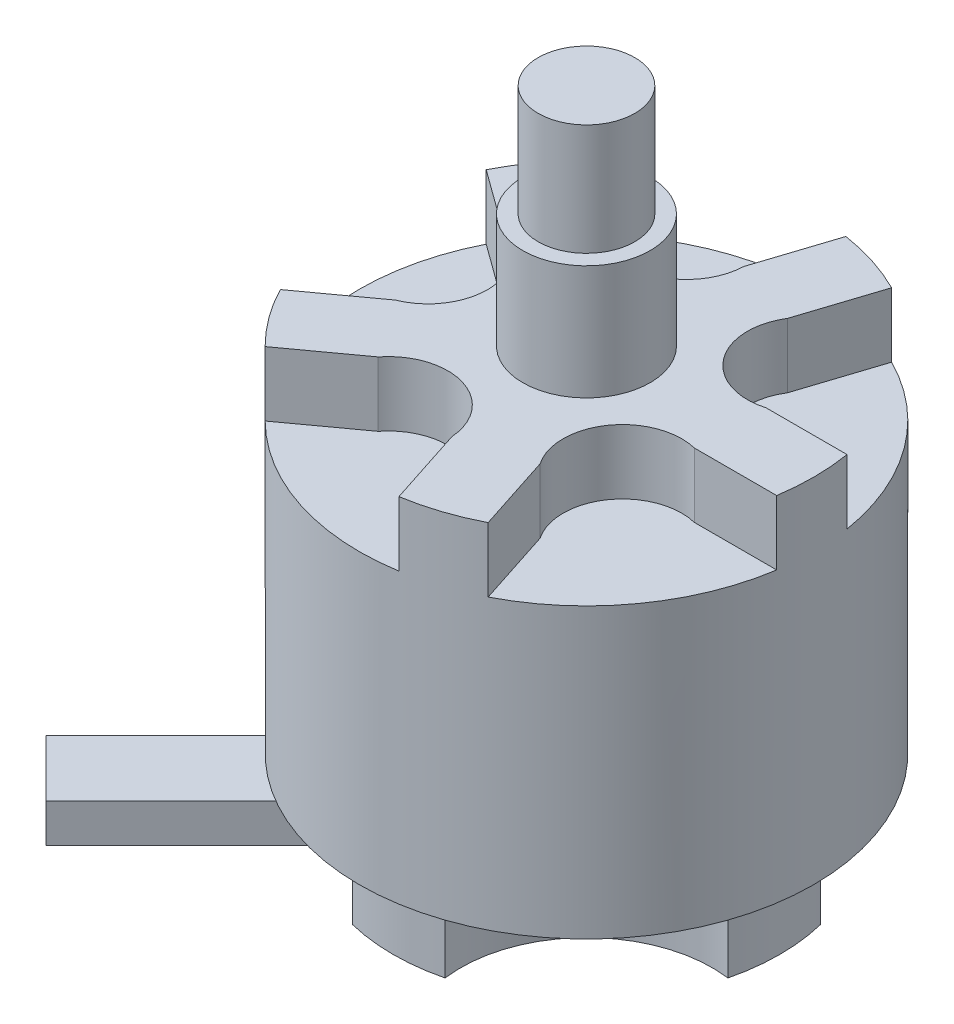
SolidWorks part; units mm, degrees
ref_plane "前视基准面" through (0, 0, 0) normal (0, 0, 1) x (1, 0, 0)
ref_plane "上视基准面" through (0, 0, 0) normal (0, 1, 0) x (1, 0, 0)
ref_plane "右视基准面" through (0, 0, 0) normal (1, 0, 0) x (0, 0, -1)
sketch "草图1" plane through (0, 0, 0) normal (0, 0, 1) x (1, 0, 0)
  line L0 (0, 0) -> (0, 40) construction
  line L1 (0, 40) -> (3, 40)
  line L2 (3, 40) -> (3, 27)
  line L3 (4, 26) -> (12.3968, 26)
  line L4 (14.3968, 22) -> (14.3968, 0)
  line L5 (14.3968, 0) -> (0, 0)
  line L6 (3, 27) -> (4, 26)
  line L7 (12.3968, 26) -> (14.3968, 22)
  line L8 (0, 40) -> (0, 0)
  point P4 (3, 26)
  point P5 (14.3968, 26)
  dimension "D1" = 2
  dimension "D2" = 4
  dimension "D4" = 3
  dimension "D5" = 40
  dimension "D6" = 26
revolve "旋转1" add sketch "草图1" angle 360 about L0
chamfer "倒角1" distance 2 angle 45 1 edges at (0, 0, -14.3968)
hole_wizard "M3 螺纹孔2" positions "草图6" profile "草图5" tap size "M3" standard "GB"
sketch "草图6" plane through (0, 0, 0) normal (0, -1, 0) x (-1, 0, 0)
  point P0 (0, -9.5)
  point P2 (-8, 0)
  point P4 (0, 9.5)
  point P6 (8, 0)
  dimension "D1" = 9.5
  dimension "D2" = 9.5
  dimension "D3" = 8
  dimension "D4" = 8
sketch "草图5" plane through (0, 0, 9.5) normal (1, 0, 0) x (0, 0, -1)
  line L0 (0, 0) -> (0, 4.5511)
  line L1 (0, 4.5511) -> (1.25, 3.8)
  line L2 (1.25, 3.8) -> (1.25, 0)
  line L5 (1.25, 0) -> (0, 0)
  line L10 (0, 4.5511) -> (-1.25, 3.8) construction
  line L11 (0, -6.35) -> (0, 107.95) construction
  dimension "螺纹孔钻头直径" = 2.5
  dimension "螺纹孔钻头深度" = 3.8
  dimension "导头角度" = 118
sketch "草图7" plane through (0, 26, 0) normal (0, 1, 0) x (1, 0, 0)
  circle A0 centre (0, 0) radius 14.1
  circle A1 centre (0, 0) radius 14.3968
  dimension "D1" = 28.2
extrude "切除-拉伸1" cut sketch "草图7" against normal blind 46
sketch "草图8" plane through (0, 0, 0) normal (0, -1, 0) x (1, 0, 0)
  circle A0 centre (0, 0) radius 12
  circle A1 centre (0, 0) radius 17.8108
extrude "切除-拉伸2" cut sketch "草图8" against normal blind 6.3
sketch "草图9" plane through (0, 26, 0) normal (0, 1, 0) x (1, 0, 0)
  circle A0 centre (0, 0) radius 12.3968
extrude "凸台-拉伸1" add sketch "草图9" along normal blind 0.7
sketch "草图10" plane through (0, 40, 0) normal (0, 1, 0) x (1, 0, 0)
  circle A0 centre (0, 0) radius 3.95
  dimension "D1" = 7.9
extrude "凸台-拉伸2" add sketch "草图10" against normal blind 13.7
sketch "草图11" plane through (0, 40, 0) normal (0, 1, 0) x (1, 0, 0)
  circle A0 centre (0, 0) radius 3.95
extrude "凸台-拉伸3" add sketch "草图11" along normal blind 0.7
sketch "草图12" plane through (0, 40.7, 0) normal (0, 1, 0) x (1, 0, 0)
  circle A0 centre (0, 0) radius 3
  circle A1 centre (0, 0) radius 7.4077
extrude "切除-拉伸3" cut sketch "草图12" against normal blind 6.9 contours A0 | A1
sketch "草图13" plane through (0, 26.7, 0) normal (0, 1, 0) x (1, 0, 0)
  circle A2 centre (0, 0) radius 12.3968 construction
  circle A4 centre (5.9676, 10.8659) radius 4.5703
  circle A5 centre (12.1782, -2.3177) radius 4.5703
  circle A6 centre (1.559, -12.2983) radius 4.5703
  circle A7 centre (-11.2147, -5.283) radius 4.5703
  circle A8 centre (-8.49, 9.0332) radius 4.5703
  point P21 (0, 0)
  dimension "D1" = 5
extrude "切除-拉伸4" cut sketch "草图13" against normal blind 6.9
sketch "草图14" plane through (0, 0, 0) normal (0, -1, 0) x (1, 0, 0)
  arc A0 (11.6501, 2.8767) -> (2.8767, 11.6501) centre (0, 0) ccw
  arc A1 (-11.6501, 2.8767) -> (-2.8767, 11.6501) centre (-10.6066, 10.6066) ccw
  arc A2 (2.8767, 11.6501) -> (11.6501, 2.8767) centre (10.6066, 10.6066) ccw
  arc A3 (11.6501, -2.8767) -> (2.8767, -11.6501) centre (10.6066, -10.6066) ccw
  arc A4 (-2.8767, -11.6501) -> (-11.6501, -2.8767) centre (-10.6066, -10.6066) ccw
  arc A5 (-11.6501, -2.8767) -> (-2.8767, -11.6501) centre (0, 0) ccw
  arc A6 (2.8767, -11.6501) -> (11.6501, -2.8767) centre (0, 0) ccw
  arc A7 (-2.8767, 11.6501) -> (-11.6501, 2.8767) centre (0, 0) ccw
  point P14 (0, 0)
  dimension "D1" = 4
extrude "切除-拉伸5" cut sketch "草图14" against normal blind 6.3
sketch "草图15" plane through (0, 0, 0) normal (0, 0, 1) x (1, 0, 0)
  line L0 (7.2283, 6.3) -> (7.2283, 4.8)
  line L1 (2.8066, 6.3) -> (11.6501, 6.3) construction
  line L2 (7.2283, 4.8) -> (16.2869, 2.923)
  line L3 (16.2869, 2.923) -> (16.2869, 6.3)
  line L4 (16.2869, 6.3) -> (7.2283, 6.3)
revolve "切除-旋转2" cut sketch "草图15" angle 360 about L0
sketch "草图18" plane through (0, 0, 0) normal (0, -1, 0) x (-1, 0, 0)
  circle A0 centre (0, 0) radius 4.82
extrude "切除-拉伸7" cut sketch "草图18" against normal blind 5
sketch "草图20" plane through (0, 5, 0) normal (0, -1, 0) x (1, 0, 0)
  line L0 (0, 1) -> (-1, 0)
  line L1 (0, 0) -> (-1, 0)
  line L2 (0, 0) -> (0, 1)
extrude "凸台-拉伸4" add sketch "草图20" along normal blind 1
ref_plane "基准面1" through (-4.0355, 0, 4.0355) normal (-0.7071, 0, 0.7071) x (0.7071, 0, 0.7071)
sketch "草图21" plane through (-4.0355, 0, 4.0355) normal (-0.7071, 0, 0.7071) x (0.7071, 0, 0.7071)
  line L1 (1.3949, 0.8304) -> (-3.6051, 0.8304)
  line L2 (1.3949, 0.8304) -> (1.3949, 3.2304)
  line L3 (1.3949, 3.2304) -> (-3.6051, 3.2304)
  line L4 (-3.6051, 0.8304) -> (-3.6051, 3.2304)
  line L5 (1.3949, 0.8304) -> (-3.6051, 3.2304) construction
  line L6 (1.3949, 3.2304) -> (-3.6051, 0.8304) construction
  point P0 (-1.1051, 2.0304)
extrude "凸台-拉伸5" add sketch "草图21" along normal blind 18 contours L3 L4 L1 L2
sketch "草图22" plane through (0, 5, 0) normal (0, -1, 0) x (1, 0, 0)
  circle A0 centre (0, 0) radius 1.4574
extrude "切除-拉伸8" cut sketch "草图22" along normal up to vertex (1.7696 mm away)
sketch "草图23" plane through (0, 26.7, 0) normal (0, 1, 0) x (1, 0, 0)
  line L4 (-16.2125, 0.7952) -> (-7.5963, -0.8447)
  line L6 (-6.755, 3.576) -> (-15.3712, 5.2158)
  line L7 (-15.3712, 5.2158) -> (-13.3285, 9.8515)
  line L8 (-13.3285, 9.8515) -> (-5.36, 5.703)
  line L9 (-5.36, 5.703) -> (-6.755, 3.576)
  line L10 (-16.2125, 0.7952) -> (-15.052, -3.7685)
  line L11 (-15.052, -3.7685) -> (-7.0802, -3.3353)
  line L12 (-7.0802, -3.3353) -> (-7.5963, -0.8447)
  arc A1 (-11.1862, 5.343) -> (-4.6398, 11.4957) centre (-8.49, 9.0332) ccw construction
  arc A2 (-8.5382, -8.9877) -> (-12.3669, -0.8604) centre (-11.2147, -5.283) ccw construction
extrude "切除-拉伸9" cut sketch "草图23" against normal up to vertex (6.9 mm away)
sketch "草图24" plane through (0, 19.8, 0) normal (0, 1, 0) x (1, 0, 0)
  circle A0 centre (0, 0) radius 14.1
extrude "凸台-拉伸7" add sketch "草图24" along normal up to vertex contours A0
sketch "草图26" plane through (0, 26.7, 0) normal (0, 1, 0) x (1, 0, 0)
  line L2 (8.8236, -2.1345) -> (13.9375, -2.1345)
  line L3 (7.05, 2.2005) -> (7.05, 2.25)
  line L4 (8.8981, 2.25) -> (13.9193, 2.25)
  line L5 (0.6966, -9.0513) -> (2.2769, -13.915)
  line L7 (4.2714, -6.025) -> (4.3184, -6.0097)
  line L8 (4.8896, -7.7673) -> (6.4412, -12.5428)
  line L9 (-8.3931, -3.4595) -> (-12.5303, -6.4654)
  line L11 (-4.4101, -5.9241) -> (-4.3811, -5.9642)
  line L12 (-5.8762, -7.0505) -> (-9.9385, -10.0019)
  line L13 (-5.8838, 6.9132) -> (-10.021, 9.9191)
  line L15 (-6.997, 2.3636) -> (-7.0261, 2.3236)
  line L16 (-8.5213, 3.4099) -> (-12.5835, 6.3613)
  line L17 (4.7567, 7.7321) -> (6.337, 12.5957)
  line L19 (0.0858, 7.3849) -> (0.0387, 7.4002)
  line L20 (0.6098, 9.1579) -> (2.1614, 13.9333)
  arc A1 (-12.5835, 6.3613) -> (-12.5303, -6.4654) centre (0, 0) ccw
  arc A2 (4.7567, 7.7321) -> (8.8981, 2.25) centre (7.8787, 5.7853) ccw
  arc A3 (8.8236, -2.1345) -> (4.8896, -7.7673) centre (7.9368, -5.7054) ccw
  arc A4 (0.6966, -9.0513) -> (-5.8762, -7.0505) centre (-2.9735, -9.3114) ccw
  arc A5 (-8.3931, -3.4595) -> (-8.5213, 3.4099) centre (-9.7745, -0.0494) ccw
  arc A6 (-5.8838, 6.9132) -> (0.6098, 9.1579) centre (-3.0675, 9.2809) ccw
  arc A7 (-9.9385, -10.0019) -> (2.2769, -13.915) centre (0, 0) ccw
  arc A8 (6.4412, -12.5428) -> (13.9375, -2.1345) centre (0, 0) ccw
  arc A9 (13.9193, 2.25) -> (6.337, 12.5957) centre (0, 0) ccw
  arc A10 (2.1614, 13.9333) -> (-10.021, 9.9191) centre (0, 0) ccw
  point P35 (0, 0)
  point P50 (0, 0)
  dimension "D1" = 5
  dimension "D2" = 5
extrude "切除-拉伸10" cut sketch "草图26" against normal blind 4.5 contours L4 A9 L17 A2 | L12 A7 L5 A4 | L16 A1 L9 A5 | L20 A10 L13 A6 | A3 L8 A8 L2
sketch "草图27" plane through (0, 22.2, 0) normal (0, 1, 0) x (1, 0, 0)
  circle A0 centre (0, 0) radius 14.1
extrude "凸台-拉伸8" add sketch "草图27" along normal blind 1.1
sketch "草图28" plane through (0, 6.3, 0) normal (0, -1, 0) x (1, 0, 0)
  circle A0 centre (0, 0) radius 14.1
extrude "凸台-拉伸9" add sketch "草图28" along normal blind 1.5
sketch "草图29" plane through (0, 23.3, 0) normal (0, 1, 0) x (1, 0, 0)
  line L0 (13.9193, 2.25) -> (8.8981, 2.25)
  line L1 (6.337, 12.5957) -> (4.7567, 7.7321)
  line L2 (6.4412, -12.5428) -> (4.8896, -7.7673)
  line L3 (13.9375, -2.1345) -> (8.8236, -2.1345)
  line L4 (-9.9385, -10.0019) -> (-5.8762, -7.0505)
  line L5 (2.2769, -13.915) -> (0.6966, -9.0513)
  line L6 (-12.5835, 6.3613) -> (-8.5213, 3.4099)
  line L7 (-12.5303, -6.4654) -> (-8.3931, -3.4595)
  line L8 (2.1614, 13.9333) -> (0.6098, 9.1579)
  line L9 (-10.021, 9.9191) -> (-5.8838, 6.9132)
  arc A0 (4.7567, 7.7321) -> (8.8981, 2.25) centre (7.8787, 5.7853) ccw
  arc A1 (13.9193, 2.25) -> (6.337, 12.5957) centre (0, 0) ccw
  arc A2 (6.4412, -12.5428) -> (13.9375, -2.1345) centre (0, 0) ccw
  arc A3 (8.8236, -2.1345) -> (4.8896, -7.7673) centre (7.9368, -5.7054) ccw
  arc A4 (-9.9385, -10.0019) -> (2.2769, -13.915) centre (0, 0) ccw
  arc A5 (0.6966, -9.0513) -> (-5.8762, -7.0505) centre (-2.9735, -9.3114) ccw
  arc A6 (-12.5835, 6.3613) -> (-12.5303, -6.4654) centre (0, 0) ccw
  arc A7 (-8.3931, -3.4595) -> (-8.5213, 3.4099) centre (-9.7745, -0.0494) ccw
  arc A8 (2.1614, 13.9333) -> (-10.021, 9.9191) centre (0, 0) ccw
  arc A9 (-5.8838, 6.9132) -> (0.6098, 9.1579) centre (-3.0675, 9.2809) ccw
  point P35 (0, 0)
  dimension "D1" = 5
extrude "切除-拉伸12" cut sketch "草图29" against normal blind 0.6 contours L0 A0 L1 A1 | A8 L9 A9 L8 | L7 A7 L6 A6 | L5 A5 L4 A4 | L3 A3 L2 A2
